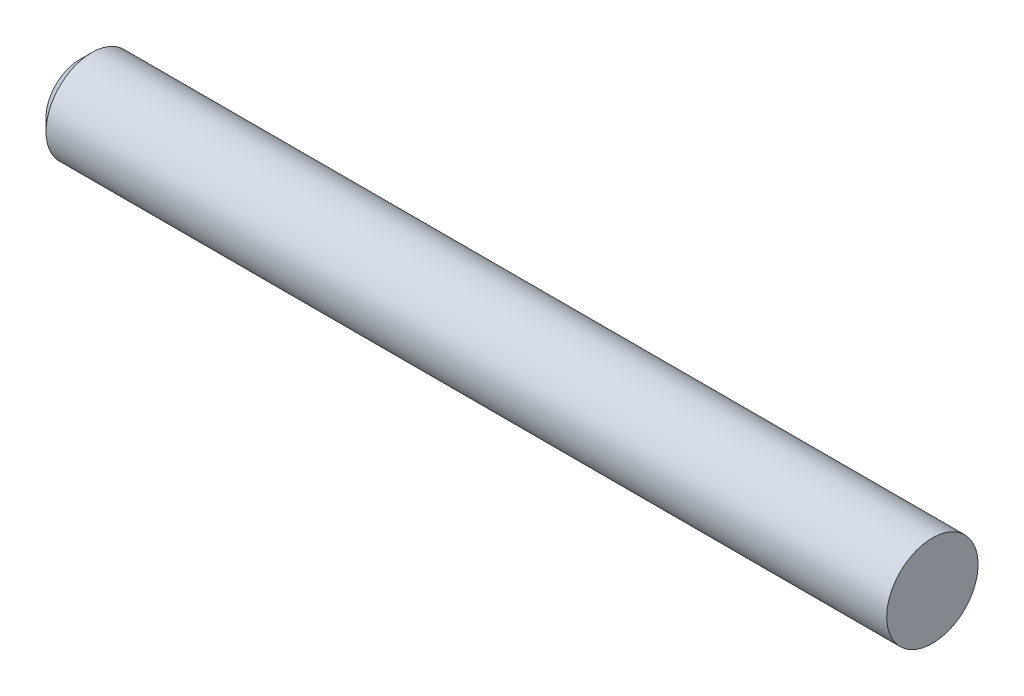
SolidWorks part; units mm, degrees
ref_plane "Front Plane" through (0, 0, 0) normal (0, 0, 1) x (1, 0, 0)
ref_plane "Top Plane" through (0, 0, 0) normal (0, 1, 0) x (1, 0, 0)
ref_plane "Right Plane" through (0, 0, 0) normal (1, 0, 0) x (0, 0, -1)
sketch "Sketch1" plane through (0, 0, 0) normal (0, 1, 0) x (1, 0, 0)
  line L1 (0, 0) -> (355.6, 0)
  line L2 (0, 0) -> (0, 19.05)
  line L3 (0, 19.05) -> (355.6, 19.05)
  line L4 (355.6, 0) -> (355.6, 19.05)
  dimension "D1" = 355.6
  dimension "D2" = 19.05
revolve "Revolve1" add sketch "Sketch1" angle 360 about L1
chamfer "Chamfer1" distance 5.08 angle 45
